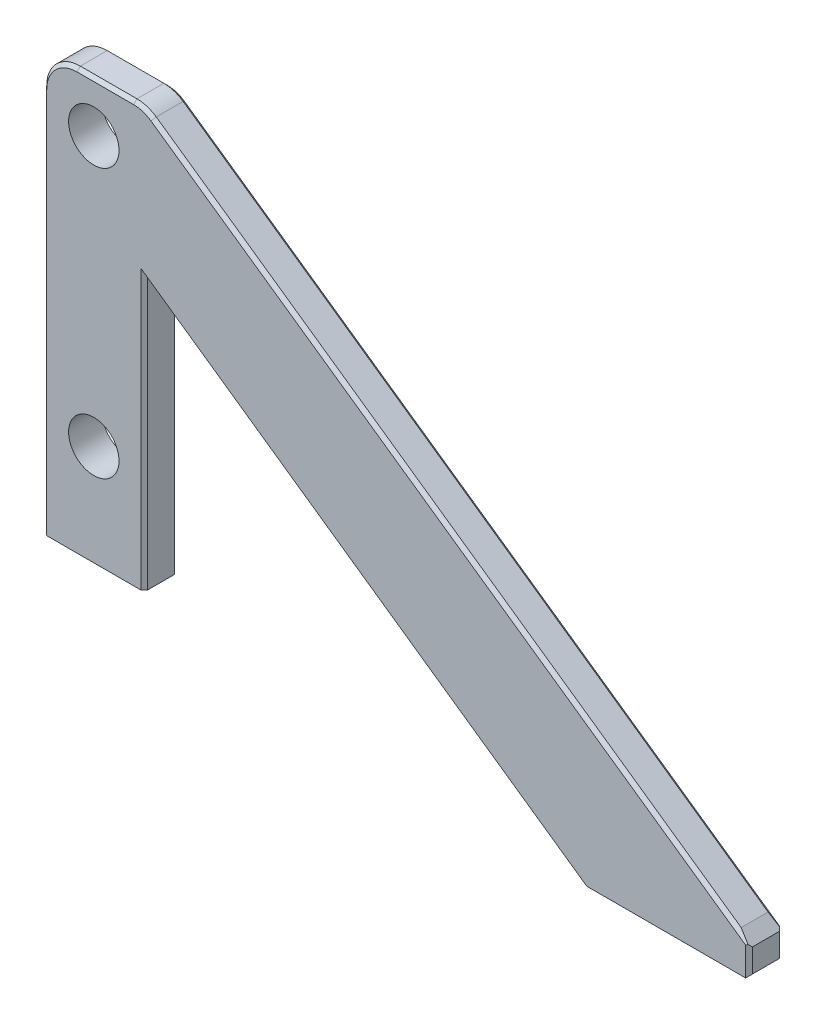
SolidWorks part; units mm, degrees
ref_plane "Plan de face" through (0, 0, 0) normal (0, 0, 1) x (1, 0, 0)
ref_plane "Plan de dessus" through (0, 0, 0) normal (0, 1, 0) x (1, 0, 0)
ref_plane "Plan de droite" through (0, 0, 0) normal (1, 0, 0) x (0, 0, -1)
sketch "Esquisse1" plane through (0, 0, 0) normal (0, 0, 1) x (1, 0, 0)
  line L0 (-129.9466, 10) -> (-159.9466, 10)
  line L1 (-159.9466, 10) -> (-159.9466, 135)
  line L2 (-159.9466, 135) -> (-129.9466, 135)
  line L3 (50, 9) -> (50, 0)
  line L4 (50, 0) -> (0, 0)
  line L5 (-129.9466, 90.9896) -> (-129.9466, 10)
  line L6 (-129.9466, 90.9896) -> (0, 0)
  line L7 (50, 9) -> (-129.9466, 135)
  line L8 (-144.9466, 3.675) -> (-144.9466, 152.4516) construction
  circle A0 centre (-144.9466, 120) radius 7.5
  circle A1 centre (-144.9466, 40) radius 7.5
  dimension "D8" = 15
  dimension "D3" = 80
  dimension "D4" = 15
  dimension "D2" = 30
  dimension "D9" = 55
  dimension "D10" = 10
  dimension "D11" = 110
  dimension "D12" = 15
  dimension "D1" = 50
  dimension "D5" = 125
  dimension "D6" = 9
  dimension "D7" = 30
extrude "Extrusion1" add sketch "Esquisse1" along normal blind 10
fillet "Congé3" radius 10 1 edges at (-159.9466, 135, 5)
fillet "Congé4" radius 10 1 edges at (-129.9466, 135, 5)
chamfer "Chanfrein1" distance 1 angle 45 7 edges at (-159.9466, 67.5, 10) (-157.0177, 132.0711, 10) (-141.5231, 135, 10) (-130.0926, 134.5372, 10) (-38.6819, 71.0958, 10) (-129.9466, 50.4948, 10) (-64.9733, 45.4948, 10)
chamfer "Chanfrein2" distance 1 angle 45 5 edges at (-159.9466, 67.5, 0) (-157.0177, 132.0711, 0) (-141.5231, 135, 0) (-130.0926, 134.5372, 0) (-38.6819, 71.0958, 0)
chamfer "Chanfrein3" distance 1 angle 45 2 edges at (-64.9733, 45.4948, 0) (-129.9466, 50.4948, 0)
chamfer "Chanfrein4" distance 1 angle 45 4 edges at (50, 3.8896, 0) (50, 0, 5) (50, 3.8896, 10) (50, 9, 5)
